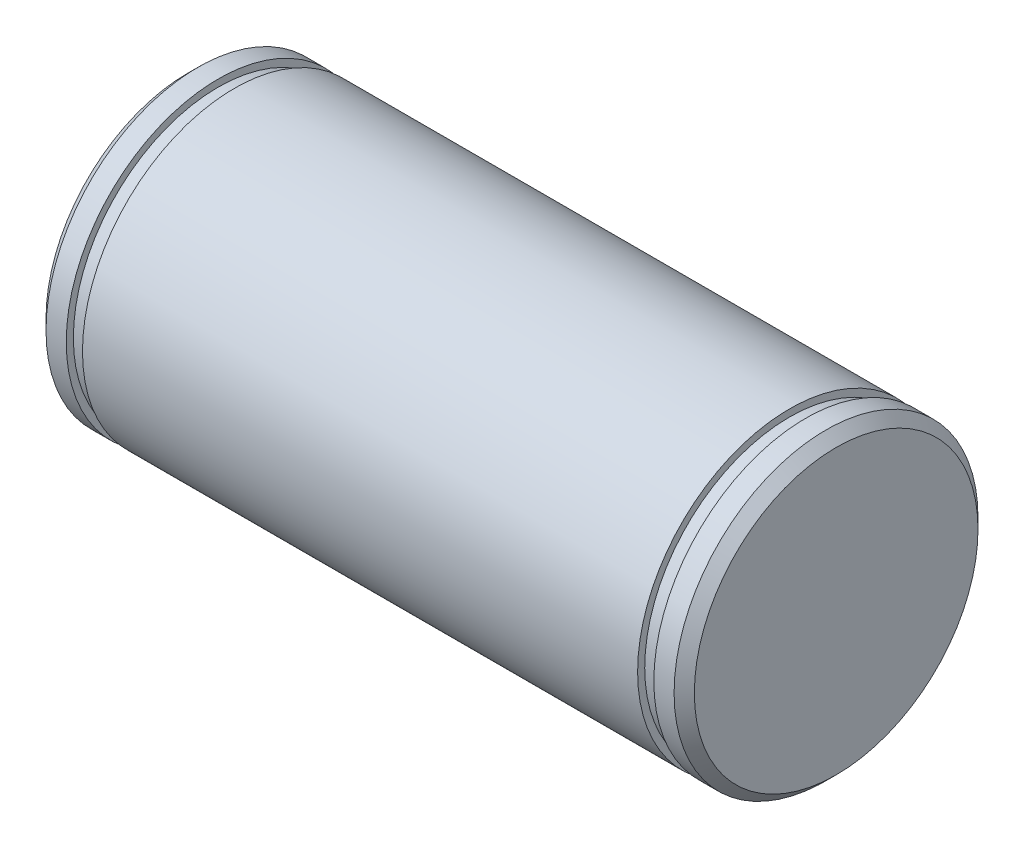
SolidWorks part; units mm, degrees
ref_plane "Face" through (0, 0, 0) normal (0, 0, 1) x (1, 0, 0)
ref_plane "Dessus" through (0, 0, 0) normal (0, 1, 0) x (1, 0, 0)
ref_plane "Droite" through (0, 0, 0) normal (1, 0, 0) x (0, 0, -1)
sketch "Esquisse1" plane through (0, 0, 0) normal (0, 0, 1) x (1, 0, 0)
  line L0 (-28.2451, 9.3159) -> (60.3554, 9.3159) construction
  line L1 (-16.9471, 23.3159) -> (-15.9471, 24.3159)
  line L2 (-16.9471, 9.3159) -> (47.0529, 9.3159)
  line L3 (-16.9471, 9.3159) -> (-16.9471, 23.3159)
  line L4 (-15.9471, 24.3159) -> (-13.9471, 24.3159)
  line L5 (47.0529, 9.3159) -> (47.0529, 23.3159)
  line L6 (44.0529, 24.3159) -> (46.0529, 24.3159)
  line L7 (42.4529, 24.3159) -> (42.4529, 23.6159)
  line L8 (42.4529, 23.6159) -> (44.0529, 23.6159)
  line L9 (44.0529, 24.3159) -> (44.0529, 23.6159)
  line L10 (-12.3471, 24.3159) -> (42.4529, 24.3159)
  line L11 (-13.9471, 24.3159) -> (-13.9471, 23.6159)
  line L12 (-13.9471, 23.6159) -> (-12.3471, 23.6159)
  line L13 (-12.3471, 24.3159) -> (-12.3471, 23.6159)
  line L14 (46.0529, 24.3159) -> (47.0529, 23.3159)
  point P3 (47.0529, 24.3159)
  point P4 (-16.9471, 24.3159)
  dimension "D1" = 30
  dimension "D2" = 28.6
  dimension "D4" = 28.6
  dimension "D6" = 58
  dimension "D7" = 3
  dimension "D8" = 3
  dimension "D11" = 1
  dimension "D12" = 1
revolve "Révolution1" add sketch "Esquisse1" angle 360 about L0
